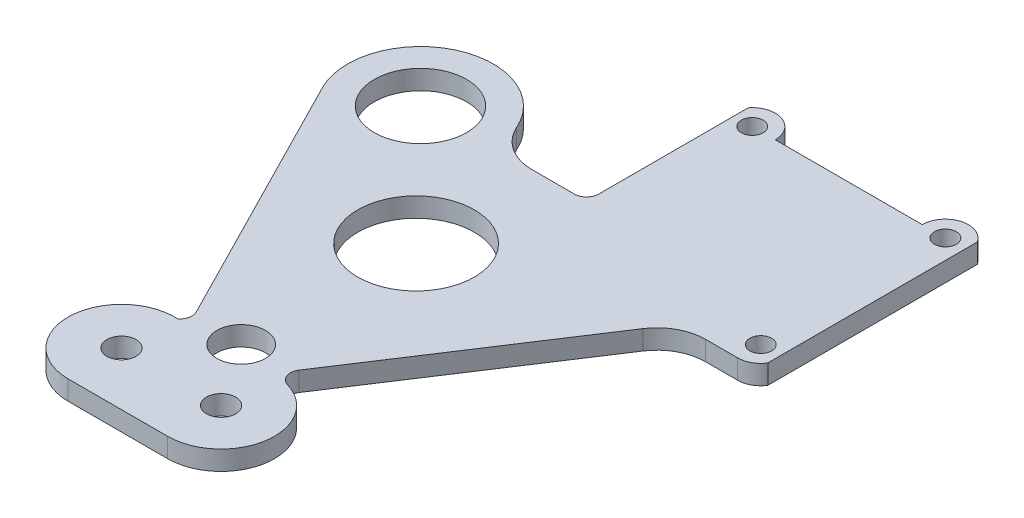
SolidWorks part; units mm, degrees
ref_plane "Plan de face" through (0, 0, 0) normal (0, 0, 1) x (1, 0, 0)
ref_plane "Plan de dessus" through (0, 0, 0) normal (0, 1, 0) x (1, 0, 0)
ref_plane "Plan de droite" through (0, 0, 0) normal (1, 0, 0) x (0, 0, -1)
sketch "Esquisse1" plane through (0, 0, 0) normal (0, 1, 0) x (1, 0, 0)
  line L0 (-20.7953, -69.7294) -> (-74.8281, 36.2762)
  line L1 (-2.4, 50.1857) -> (15, 50.1857)
  line L2 (20, 55.1857) -> (20, 116.731)
  line L3 (37, 110.9) -> (97.5, 110.9)
  line L4 (115, 116.0235) -> (115, 29.7765)
  line L5 (107, 25.4) -> (93.8031, 25.4)
  line L6 (77.0658, 16.3482) -> (21.0657, -69.2629)
  line L7 (17.6218, -119.9) -> (-23.3782, -119.9)
  line L8 (-25.25, -72) -> (25.25, -72) construction
  arc A0 (-74.8281, 36.2762) -> (-20.68, 62.0714) centre (-48.1, 49.9) cw
  arc A2 (15, 50.1857) -> (20, 55.1857) centre (15, 55.1857) ccw
  arc A3 (20, 116.731) -> (37, 110.9) centre (27.5, 110.9) cw
  arc A4 (97.5, 110.9) -> (115, 116.0235) centre (107, 110.9) cw
  arc A5 (115, 29.7765) -> (107, 25.4) centre (107, 34.9) cw
  arc A6 (93.8031, 25.4) -> (77.0658, 16.3482) centre (93.8031, 5.4) ccw
  arc A7 (21.0657, -69.2629) -> (23.8374, -76.7963) centre (25.25, -72) ccw
  arc A8 (23.8374, -76.7963) -> (17.6218, -119.9) centre (17.6218, -97.9) cw
  arc A9 (-23.3782, -119.9) -> (-22.1634, -75.9336) centre (-23.3782, -97.9) cw
  arc A10 (-22.1634, -75.9336) -> (-20.7953, -69.7294) centre (-25.25, -72) ccw
  circle A11 centre (0, 0) radius 24
  circle A12 centre (-48.1, 49.9) radius 19
  circle A13 centre (0, -72) radius 10
  circle A14 centre (-23.3782, -97.9) radius 6
  circle A15 centre (17.6218, -97.9) radius 6
  circle A16 centre (107, 110.9) radius 4.5
  circle A17 centre (107, 34.9) radius 4.5
  circle A18 centre (27.5, 110.9) radius 4.5
  arc A19 (-2.4, 50.1857) -> (-20.68, 62.0714) centre (-2.4, 70.1857) cw
  dimension "D1" = 48
  dimension "D2" = 38
  dimension "D3" = 30
  dimension "D4" = 9
  dimension "D5" = 9.5
  dimension "D6" = 20
  dimension "D7" = 5
  dimension "D8" = 22
  dimension "D9" = 12
  dimension "D10" = 20
  dimension "D11" = 5
  dimension "D12" = 20
  dimension "D13" = 41
  dimension "D14" = 22
  dimension "D15" = 48.1
  dimension "D16" = 49.9
  dimension "D17" = 20
  dimension "D18" = 95
  dimension "D19" = 85.5
  dimension "D20" = 25.4
  dimension "D21" = 8
  dimension "D22" = 7.5
  dimension "D23" = 72
  dimension "D24" = 25.9
  dimension "D25" = 50.5
  dimension "D26" = 102.3
  dimension "D27" = 17.4
extrude "Extrusion1" add sketch "Esquisse1" along normal blind 8
